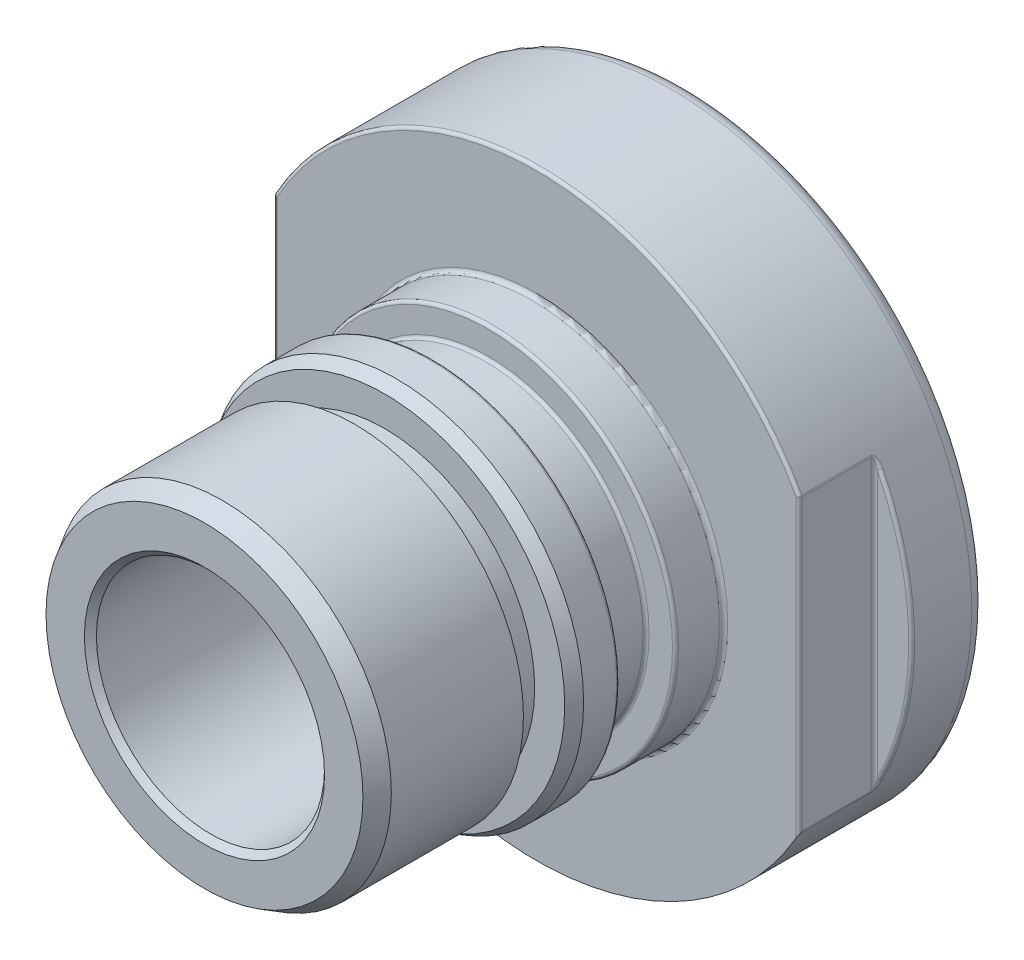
SolidWorks part; units mm, degrees
ref_plane "Plane1" through (0, 0, 0) normal (0, 0, 1) x (1, 0, 0)
ref_plane "Plane2" through (0, 0, 0) normal (0, 1, 0) x (1, 0, 0)
ref_plane "Plane3" through (0, 0, 0) normal (1, 0, 0) x (0, 0, -1)
sketch "Sketch1" plane through (0, 0, 0) normal (0, 0, 1) x (1, 0, 0)
  circle A0 centre (0, 0) radius 12.7
  dimension "D1" = 25.4
extrude "bladder_base" add sketch "Sketch1" along normal blind 6.35
sketch "Sketch5" plane through (0, 0, 6.35) normal (0, 0, 1) x (1, 0, 0)
  circle A0 centre (0, 0) radius 7.9121
  dimension "D1" = 15.8242
sketch "Sketch16" plane through (0, 0, 0) normal (0, 0, -1) x (-1, 0, 0)
  circle A0 centre (0, 0) radius 5.5499
  dimension "D1" = 11.0998
extrude "oring_base" add sketch "Sketch5" along normal blind 2.032
sketch "Sketch17" plane through (0, 0, 8.382) normal (0, 0, 1) x (1, 0, 0)
  circle A0 centre (0, 0) radius 6.6675
  dimension "D1" = 13.335
extrude "oring_groove" add sketch "Sketch17" along normal blind 2.3622
sketch "Sketch18" plane through (0, 0, 10.7442) normal (0, 0, 1) x (1, 0, 0)
  circle A0 centre (0, 0) radius 7.9121
  dimension "D1" = 15.8242
extrude "oring_base2" add sketch "Sketch18" along normal blind 2.032
sketch "Sketch19" plane through (0, 0, 12.7762) normal (0, 0, 1) x (1, 0, 0)
  circle A0 centre (0, 0) radius 7.1438
  dimension "D1" = 14.2875
extrude "thread_plug" add sketch "Sketch19" along normal blind 7.62
extrude "bladder_cbore" cut sketch "Sketch16" against normal blind 7.62
sketch "Sketch22" plane through (0, 0, 7.62) normal (0, 0, -1) x (-1, 0, 0)
  circle A0 centre (0, 0) radius 3.175
  dimension "D1" = 6.35
extrude "thru_hole" cut sketch "Sketch22" against normal blind 2.54
sketch "Sketch23" plane through (0, 0, 10.16) normal (0, 0, -1) x (-1, 0, 0)
  circle A0 centre (0, 0) radius 4.826
  dimension "D1" = 9.652
extrude "bolt_cbore" cut sketch "Sketch23" against normal blind 12.7
chamfer "Chamfer1" distance 0.762 angle 30 1 edges at (7.1438, 0, 20.3962)
sketch "Sketch24" plane through (0, 0, 12.7762) normal (0, 0, 1) x (1, 0, 0)
  circle A0 centre (0, 0) radius 6.35
  dimension "D1" = 12.7
extrude "Cut-Extrude9" cut sketch "Sketch24" along normal blind 1.27 flip side to cut
chamfer "Chamfer2" distance 0.508 angle 30 1 edges at (7.9121, 0, 12.7762)
sketch "Sketch27" plane through (0, 0, 6.35) normal (0, 0, 1) x (1, 0, 0)
  line L0 (0, 0) -> (0, 12.7) construction
  line L1 (-15.2744, 11.1125) -> (-11.1125, 11.1125)
  line L2 (-15.2744, -11.1125) -> (-15.2744, 11.1125)
  line L3 (-11.1125, -11.1125) -> (-15.2744, -11.1125)
  line L4 (-11.1125, 11.1125) -> (-11.1125, -11.1125)
  line L10 (11.1125, 11.1125) -> (11.1125, -11.1125)
  line L11 (11.1125, -11.1125) -> (15.2744, -11.1125)
  line L12 (15.2744, -11.1125) -> (15.2744, 11.1125)
  line L13 (15.2744, 11.1125) -> (11.1125, 11.1125)
  circle A0 centre (0, 0) radius 12.7 construction
  dimension "D1" = 11.1125
extrude "Cut-Extrude10" cut sketch "Sketch27" against normal blind 3.175
fillet "Fillet1" radius 0.635 1 edges at (12.7, 0, 0)
fillet "Fillet2" radius 0.1778 1 edges at (7.9121, 0, 6.35)
fillet "Fillet3" radius 0.127 10 edges at (-11.1125, -6.1484, 4.7625) (-11.1125, 6.1484, 4.7625) (11.1125, 6.1484, 4.7625) (11.1125, -6.1484, 4.7625) (-11.1125, 0, 6.35) (-12.7, 0, 3.175) (-11.1125, 0, 3.175) (11.1125, 0, 3.175) (12.7, 0, 3.175) (11.1125, 0, 6.35)
fillet "Fillet4" radius 0.127 4 edges at (7.9121, 0, 10.7442) (6.6675, 0, 10.7442) (6.6675, 0, 8.382) (7.9121, 0, 8.382)
chamfer "Chamfer3" distance 0.254 angle 45 1 edges at (4.826, 0, 20.3962)
chamfer "Chamfer4" distance 0.635 angle 45 1 edges at (-5.5499, 0, 0)
fillet "Fillet5" radius 0.127 4 edges at (11.1084, 6.1474, 6.2549) (-11.1084, 6.1474, 6.2549) (-5.5499, 0, 7.62) (0, 12.7, 6.35)
sketch "Sketch28" plane through (0, 0, 0) normal (0, 1, 0) x (1, 0, 0)
  line L0 (0, 0) -> (0, 2.8526) construction
  line L2 (11.677, 0) -> (11.677, 0.3076)
  line L3 (11.677, 0.3076) -> (7.4676, 0.3076)
  line L4 (7.8622, -0.3946) -> (7.4676, 0)
  line L9 (8.0418, -0.3946) -> (8.3992, -0.0372)
  line L12 (8.5789, -0.0372) -> (8.9363, -0.3946)
  line L13 (7.4676, 0) -> (7.4676, 0.3076)
  line L16 (9.1159, -0.3946) -> (9.4733, -0.0372)
  line L19 (9.6529, -0.0372) -> (10.0104, -0.3946)
  line L22 (10.19, -0.3946) -> (10.5474, -0.0372)
  line L25 (10.727, -0.0372) -> (11.0844, -0.3946)
  line L27 (11.264, -0.3946) -> (11.2732, -0.4038)
  line L28 (11.2732, -0.4038) -> (11.677, 0)
  line L29 (12.065, 0) -> (-12.065, 0) construction
  arc A0 (7.8622, -0.3946) -> (8.0418, -0.3946) centre (7.952, -0.3048) ccw
  arc A1 (8.5789, -0.0372) -> (8.3992, -0.0372) centre (8.4891, -0.127) ccw
  arc A2 (8.9363, -0.3946) -> (9.1159, -0.3946) centre (9.0261, -0.3048) ccw
  arc A3 (9.6529, -0.0372) -> (9.4733, -0.0372) centre (9.5631, -0.127) ccw
  arc A4 (10.0104, -0.3946) -> (10.19, -0.3946) centre (10.1002, -0.3048) ccw
  arc A5 (10.727, -0.0372) -> (10.5474, -0.0372) centre (10.6372, -0.127) ccw
  arc A6 (11.0844, -0.3946) -> (11.264, -0.3946) centre (11.1742, -0.3048) ccw
  dimension "D1" = 7.4676
  dimension "D2" = 90
revolve "Cut-Revolve1" cut sketch "Sketch28" angle 360 about L0
fillet "Fillet6" radius 0.254 2 edges at (7.4676, 0, 0) (11.677, 0, 0)
